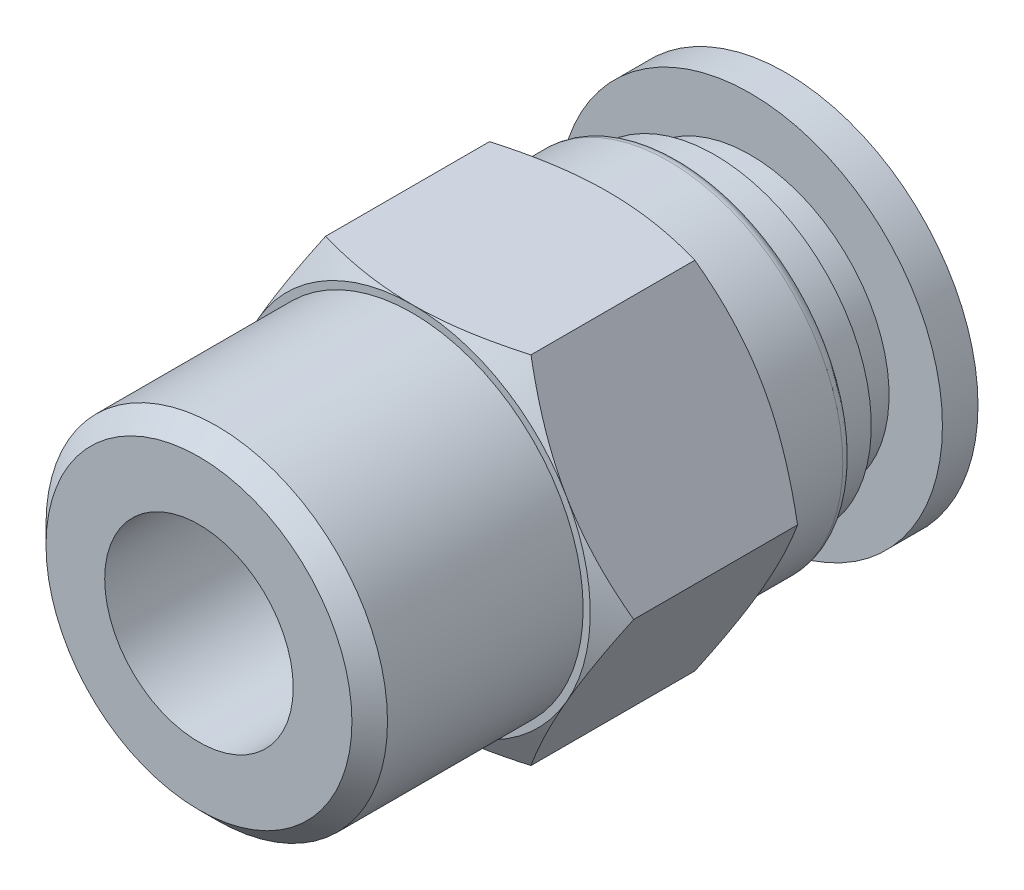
SolidWorks part; units mm, degrees
other "ÊäÈë1"
ref_plane "Ebene vorne" through (0, 0, 0) normal (0, 0, 1) x (1, 0, 0)
ref_plane "Ebene oben" through (0, 0, 0) normal (0, 1, 0) x (1, 0, 0)
ref_plane "Ebene rechts" through (0, 0, 0) normal (1, 0, 0) x (0, 0, -1)
imported_body "Importiert1"
sketch "Skizze1" plane through (0, 0, 0) normal (1, 0, 0) x (0, 0, -1)
  line L0 (-5.5, 5) -> (-5.5, 6.593)
  line L1 (-5.5, 6.593) -> (-4.5803, 6.593)
  line L2 (-4.5803, 6.593) -> (-5.5, 5)
  line L3 (-2.75, 5) -> (-2.75, 8.0576) construction
  line L4 (0, 5) -> (-5.5, 5) construction
  line L5 (-0.9197, 6.593) -> (0, 5)
  line L6 (0, 6.593) -> (-0.9197, 6.593)
  line L7 (0, 5) -> (0, 6.593)
  line L8 (0, 0) -> (-15.3681, 0) construction
  line L9 (0, -4.9) -> (0, 4.9) construction
  dimension "D1" = 30
revolve "Schnitt-Rotation1" cut sketch "Skizze1" angle 360 about L8
